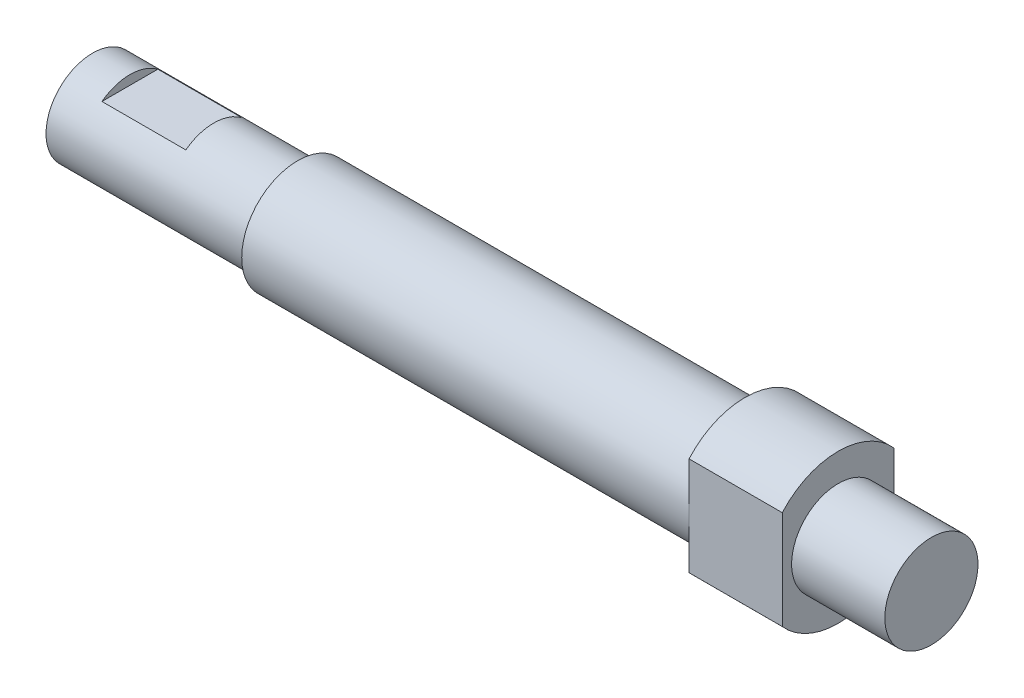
SolidWorks part; units mm, degrees
ref_plane "Plan de face" through (0, 0, 0) normal (0, 0, 1) x (1, 0, 0)
ref_plane "Plan de dessus" through (0, 0, 0) normal (0, 1, 0) x (1, 0, 0)
ref_plane "Plan de droite" through (0, 0, 0) normal (1, 0, 0) x (0, 0, -1)
sketch "Esquisse1" plane through (0, 0, 0) normal (0, 0, 1) x (1, 0, 0)
  line L0 (-13.6442, 0) -> (50.2257, 0) construction
  line L1 (0, 0) -> (45, 0)
  line L2 (0, 0) -> (0, 4)
  line L3 (0, 4) -> (45, 4)
  line L4 (45, 0) -> (45, 4)
  dimension "D1" = 45
  dimension "D2" = 4
revolve "Révolution1" add sketch "Esquisse1" angle 360 about L0
sketch "Esquisse2" plane through (45, 0, 0) normal (1, 0, 0) x (0, 0, -1)
  circle A0 centre (0, 0) radius 2.5
  circle A1 centre (0, 0) radius 4 construction
  circle A2 centre (0, 0) radius 4
  dimension "D1" = 5
extrude "Enlèv. mat.-Extru.1" cut sketch "Esquisse2" against normal blind 5
sketch "Esquisse3" plane through (0, 0, 0) normal (-1, 0, 0) x (0, 0, 1)
  circle A0 centre (0, 0) radius 3
  circle A1 centre (0, 0) radius 4 construction
  circle A2 centre (0, 0) radius 4
  dimension "D1" = 6
extrude "Enlèv. mat.-Extru.2" cut sketch "Esquisse3" against normal blind 35
sketch "Esquisse4" plane through (0, 0, 0) normal (-1, 0, 0) x (0, 0, 1)
  circle A0 centre (0, 0) radius 2.5
  circle A1 centre (0, 0) radius 3 construction
  circle A2 centre (0, 0) radius 3
  dimension "D1" = 5
extrude "Enlèv. mat.-Extru.3" cut sketch "Esquisse4" against normal blind 11
ref_plane "Plan1" through (0, 0, -4) normal (0, 0, 1) x (1, 0, 0)
sketch "Esquisse5" plane through (0, 0, -4) normal (0, 0, 1) x (1, 0, 0)
  line L0 (35, 4) -> (35, -4) construction
  line L1 (40, 4) -> (35, 4)
  line L2 (40, 4) -> (40, -4)
  line L3 (40, -4) -> (35, -4)
  line L4 (35, 4) -> (35, -4)
extrude "Enlèv. mat.-Extru.4" cut sketch "Esquisse5" along normal blind 1
sketch "Esquisse6" plane through (0, 0, 0) normal (0, 0, 1) x (1, 0, 0)
  line L0 (48.4619, 0) -> (-10.208, 0) construction
pattern_circular "Répétition circulaire1" count 2 every 180 about axis through (48.4619, 0, 0) along (-1, 0, 0) of "Enlèv. mat.-Extru.4"
ref_plane "Plan2" through (0, 2.5, 0) normal (0, 1, 0) x (1, 0, 0)
sketch "Esquisse7" plane through (0, 2.5, 0) normal (0, 1, 0) x (1, 0, 0)
  line L0 (11, 2.5) -> (0, 2.5) construction
  line L1 (2, 2.5) -> (6.5, 2.5)
  line L2 (2, 2.5) -> (2, -2.5)
  line L3 (2, -2.5) -> (6.5, -2.5)
  line L4 (6.5, 2.5) -> (6.5, -2.5)
  line L6 (0, 2.5) -> (0, -2.5) construction
  dimension "D1" = 2
  dimension "D2" = 4.5
extrude "Enlèv. mat.-Extru.5" cut sketch "Esquisse7" against normal blind 0.5
